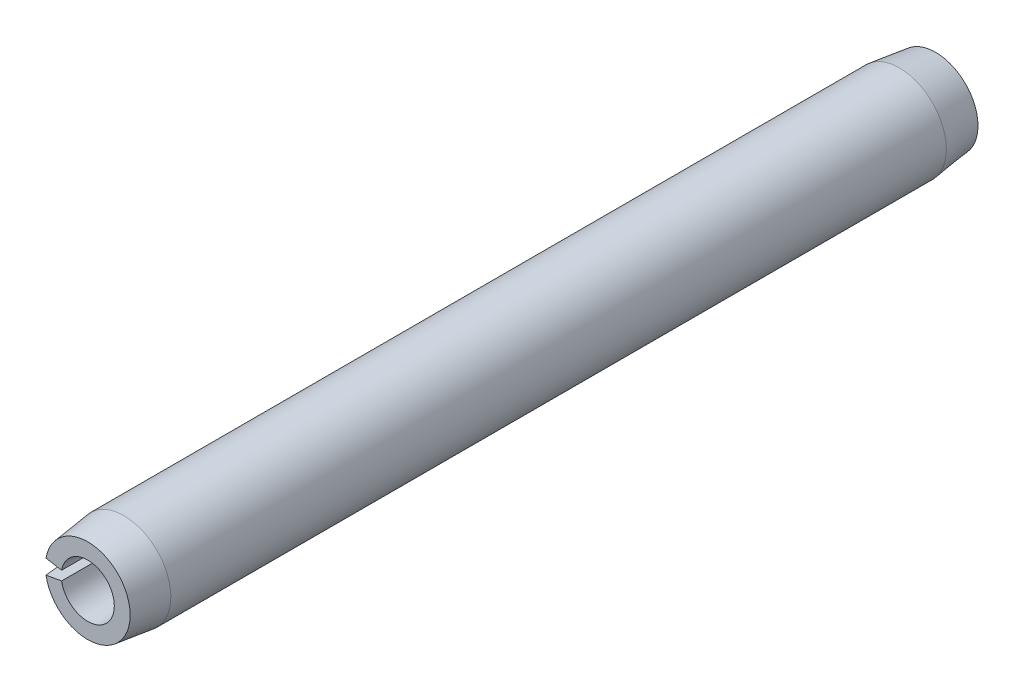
SolidWorks part; units mm, degrees
ref_plane "Front Plane" through (0, 0, 0) normal (0, 0, 1) x (1, 0, 0)
ref_plane "Top Plane" through (0, 0, 0) normal (0, 1, 0) x (1, 0, 0)
ref_plane "Right Plane" through (0, 0, 0) normal (1, 0, 0) x (0, 0, -1)
sketch "Sketch5" plane through (0, 0, 0) normal (0, 0, 1) x (1, 0, 0)
  line L0 (0.5969, 0) -> (1.0541, 0) construction
  line L1 (-1.0381, 0.183) -> (-0.5878, 0.1037)
  line L2 (-0.5878, -0.1037) -> (-1.0381, -0.183)
  arc A0 (-1.0381, -0.183) -> (-1.0381, 0.183) centre (0, 0) ccw
  arc A1 (-0.5878, -0.1037) -> (-0.5878, 0.1037) centre (0, 0) ccw
  dimension "Diameter" = 2.1082
  dimension "Wall Thickness" = 0.4572
  dimension "D3" = 20
sketch "Sketch6" plane through (0, 0, 0) normal (1, 0, 0) x (0, 0, -1)
  line L0 (9.525, 0) -> (-9.525, 0) construction
  line L1 (0, 1.0541) -> (0, -1.0541) construction
  line L4 (0, 1.0541) -> (0, -1.0541) construction
  line L5 (9.525, 0) -> (9.525, 1.0541) construction
  line L6 (9.525, 1.0541) -> (-9.525, 1.0541) construction
  line L7 (-9.525, 1.0541) -> (-9.525, 0) construction
  line L8 (9.525, 0.9525) -> (8.7122, 1.0541)
  dimension "Length" = 19.05
  dimension "Chamfer" = 0.8128
  dimension "Chamfer Dia." = 1.905
sketch "Sketch1" plane through (0, 0, 0) normal (0, 0, 1) x (1, 0, 0)
  line L1 (-0.5878, -0.1037) -> (-1.0381, -0.183) construction
  line L2 (-1.0381, 0.183) -> (-0.5878, 0.1037) construction
  line L3 (-0.5878, -0.1037) -> (-1.0381, -0.183)
  line L4 (-1.0381, 0.183) -> (-0.5878, 0.1037)
  arc A2 (-1.0381, -0.183) -> (-1.0381, 0.183) centre (0, 0) ccw construction
  arc A3 (-0.5878, -0.1037) -> (-0.5878, 0.1037) centre (0, 0) ccw construction
  arc A4 (-1.0381, -0.183) -> (-1.0381, 0.183) centre (0, 0) ccw
  arc A5 (-0.5878, -0.1037) -> (-0.5878, 0.1037) centre (0, 0) ccw
extrude "Extrude1" add sketch "Sketch1" against normal up to vertex (9.525 mm away) and the other way up to vertex (9.525 mm away)
sketch "Sketch2" plane through (0, 0, 0) normal (1, 0, 0) x (0, 0, -1)
  line L0 (9.525, 0.9525) -> (8.7122, 1.0541)
  line L1 (8.7122, 1.0541) -> (9.525, 1.0541)
  line L4 (9.525, 1.0541) -> (9.525, 0.9525)
revolve "Cut-Revolve1" cut sketch "Sketch2" angle 360 about L0
mirror "Mirror1" about plane through (0, 0, 0) normal (0, 0, 1) of "Cut-Revolve1"
sketch "Sketch3" plane through (0, 0, 0) normal (0, 0, 1) x (1, 0, 0)
  line L1 (0.5969, 0) -> (1.0541, 0)
  circle A0 centre (0, 0) radius 0.5969
  circle A1 centre (0, 0) radius 1.0541
